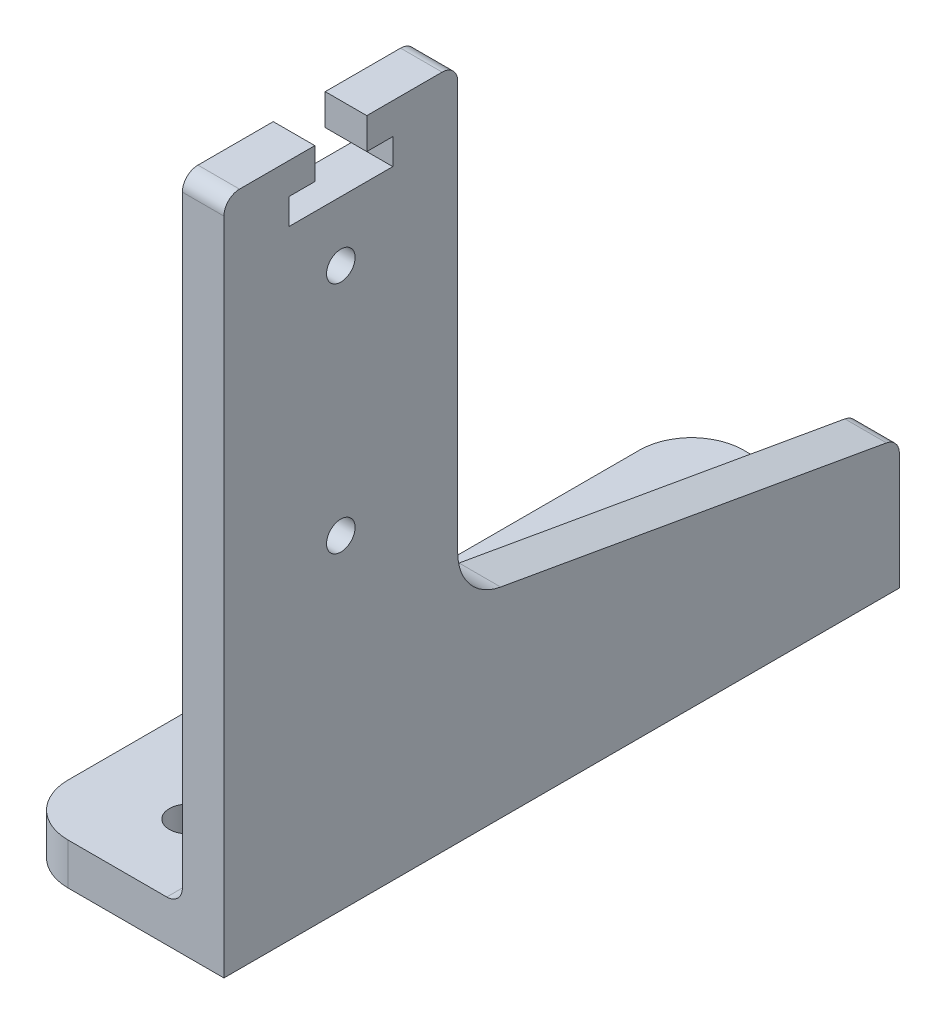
SolidWorks part; units mm, degrees
other "<Equerre>-<Congé1>"
ref_plane "Plan de face" through (0, 0, 0) normal (0, 0, 1) x (1, 0, 0)
ref_plane "Plan de dessus" through (0, 0, 0) normal (0, 1, 0) x (1, 0, 0)
ref_plane "Plan de droite" through (0, 0, 0) normal (1, 0, 0) x (0, 0, -1)
mirrored part "Equerre_Symétrique"
